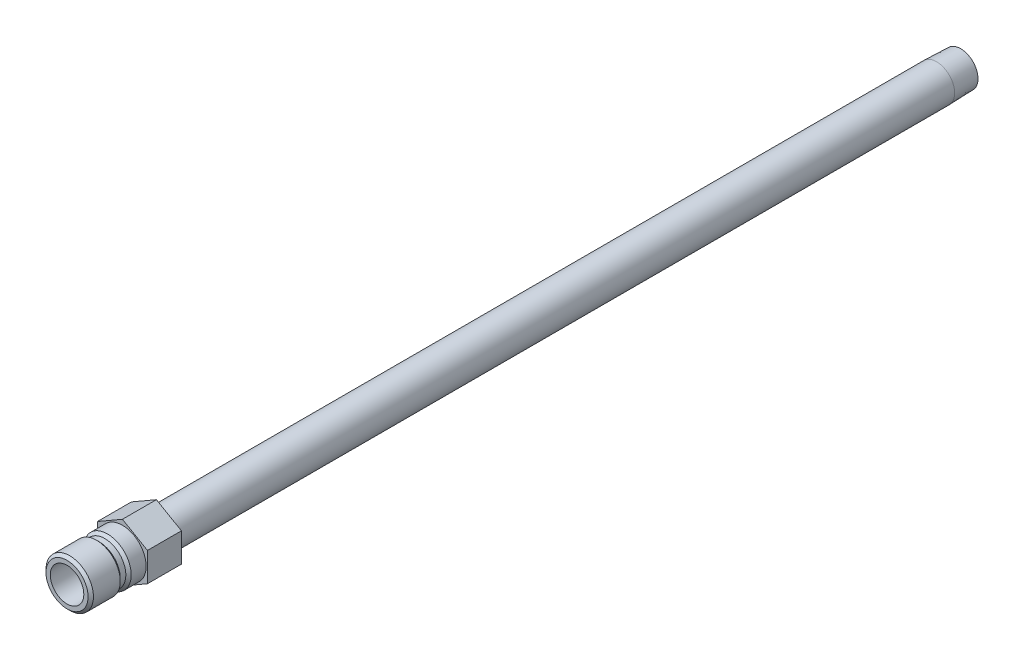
SolidWorks part; units mm, degrees
ref_plane "Front Plane" through (0, 0, 0) normal (0, 0, 1) x (1, 0, 0)
ref_plane "Top Plane" through (0, 0, 0) normal (0, 1, 0) x (1, 0, 0)
ref_plane "Right Plane" through (0, 0, 0) normal (1, 0, 0) x (0, 0, -1)
sketch "Sketch1" plane through (0, 0, 0) normal (1, 0, 0) x (0, 0, -1)
  line L0 (9.652, 0) -> (-18.923, 0) construction
  line L1 (-15.748, 4.7625) -> (-15.748, 5.9817)
  line L2 (-6.604, 5.9817) -> (-6.604, 0) construction
  line L3 (-14.986, 6.7437) -> (-7.366, 6.7437)
  line L4 (9.652, 5.1435) -> (9.652, 0) construction
  line L5 (-6.604, 5.9817) -> (-5.0165, 5.9817)
  line L6 (-4.2545, 6.7437) -> (9.652, 6.7437)
  line L7 (9.652, 6.7437) -> (9.652, 5.1435)
  line L8 (-6.604, 5.9817) -> (-7.366, 6.7437)
  line L9 (-5.0165, 5.9817) -> (-4.2545, 6.7437)
  line L10 (-15.748, 5.9817) -> (-14.986, 6.7437)
  line L11 (-15.748, 4.7625) -> (-3.556, 4.7625)
  line L12 (9.652, 5.1435) -> (231.394, 5.1435)
  line L13 (231.394, 5.1435) -> (238.252, 4.9292)
  line L14 (238.252, 4.9292) -> (238.252, 3.4163)
  line L15 (0, 0) -> (0, 6.7437) construction
  line L16 (9.652, 6.731) -> (9.652, 0) construction
  line L17 (-3.556, 4.7625) -> (-2.8402, 3.4163)
  line L19 (-2.8402, 3.4163) -> (238.252, 3.4163)
  dimension "D2" = 1.5875
  dimension "D3" = 0.762
  dimension "D4" = 45
  dimension "D5" = 9.144
  dimension "D6" = 45
  dimension "D7" = 1.79
  dimension "D8" = 6.858
  dimension "D9" = 254
  dimension "D10" = 3.175
  dimension "D11" = 9.525
  dimension "D12" = 10.287
  dimension "D13" = 25.4
  dimension "D14" = 13.4874
  dimension "D15" = 6.8326
  dimension "D16" = 12.192
  dimension "D17" = 9.652
  dimension "D18" = 118
revolve "Revolve1" add sketch "Sketch1" angle 360 about L0
sketch "Sketch2" plane through (0, 0, 0) normal (0, 0, 1) x (1, 0, 0)
  line L1 (-7.112, 4.1061) -> (-7.112, -4.1061)
  line L2 (-7.112, -4.1061) -> (0, -8.2122)
  line L3 (0, -8.2122) -> (7.112, -4.1061)
  line L4 (7.112, -4.1061) -> (7.112, 4.1061)
  line L5 (7.112, 4.1061) -> (0, 8.2122)
  line L6 (0, 8.2122) -> (-7.112, 4.1061)
  circle A0 centre (0, 0) radius 7.112 construction
  circle A1 centre (0, 0) radius 4.7625 construction
  circle A2 centre (0, 0) radius 4.7625
  dimension "D1" = 14.224
extrude "Boss-Extrude1" add sketch "Sketch2" against normal up to vertex (9.652 mm away)
